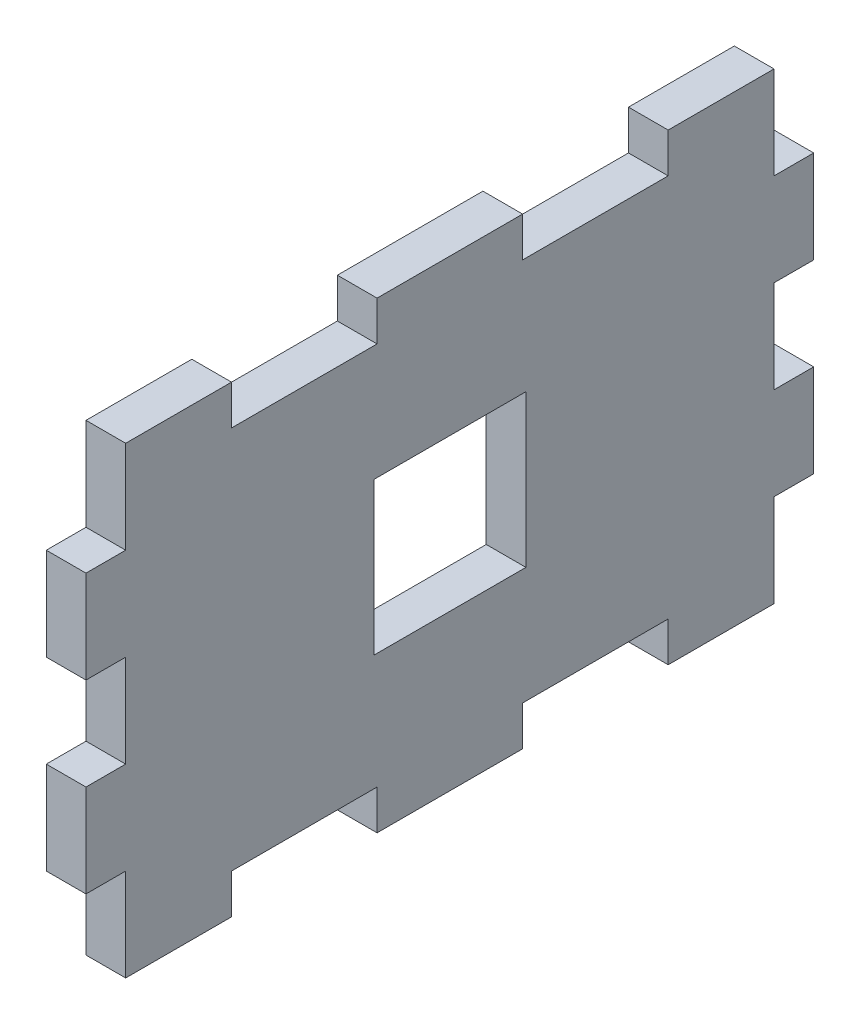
SolidWorks part; units mm, degrees
ref_plane "Front Plane" through (0, 0, 0) normal (0, 0, 1) x (1, 0, 0)
ref_plane "Top Plane" through (0, 0, 0) normal (0, 1, 0) x (1, 0, 0)
ref_plane "Right Plane" through (0, 0, 0) normal (1, 0, 0) x (0, 0, -1)
sketch "Sketch1" plane through (0, 0, 0) normal (1, 0, 0) x (0, 0, -1)
  line L1 (-27.5, 17.5) -> (27.5, 17.5)
  line L2 (-27.5, 17.5) -> (-27.5, -17.5)
  line L3 (-27.5, -17.5) -> (27.5, -17.5)
  line L4 (27.5, 17.5) -> (27.5, -17.5)
  line L5 (-27.5, 17.5) -> (27.5, -17.5) construction
  line L6 (-27.5, -17.5) -> (27.5, 17.5) construction
  point P0 (0, 0)
  dimension "D1" = 55
  dimension "D2" = 35
extrude "Boss-Extrude1" add sketch "Sketch1" along normal blind 3
sketch "Sketch3" plane through (3, 0, 0) normal (1, 0, 0) x (0, 0, -1)
  line L0 (-27.5, 17.5) -> (-16.5, 17.5)
  line L1 (27.5, 17.5) -> (-27.5, 17.5) construction
  line L2 (-16.5, 17.5) -> (-16.5, 14.5)
  line L3 (-16.5, 14.5) -> (-5.5, 14.5)
  line L4 (-5.5, 14.5) -> (-5.5, 17.5)
  line L5 (-5.5, 17.5) -> (5.5, 17.5)
  line L6 (5.5, 17.5) -> (5.5, 14.5)
  line L7 (5.5, 14.5) -> (16.5, 14.5)
  line L8 (16.5, 14.5) -> (16.5, 17.5)
  line L9 (16.5, 17.5) -> (27.5, 17.5)
  line L10 (-27.5, 0) -> (27.5, 0) construction
  line L11 (-27.5, 17.5) -> (-27.5, -17.5) construction
  line L12 (27.5, -17.5) -> (27.5, 17.5) construction
  line L13 (16.5, -17.5) -> (27.5, -17.5)
  line L14 (16.5, -14.5) -> (16.5, -17.5)
  line L15 (5.5, -14.5) -> (16.5, -14.5)
  line L16 (5.5, -17.5) -> (5.5, -14.5)
  line L17 (-5.5, -17.5) -> (5.5, -17.5)
  line L18 (-5.5, -14.5) -> (-5.5, -17.5)
  line L19 (-16.5, -14.5) -> (-5.5, -14.5)
  line L20 (-16.5, -17.5) -> (-16.5, -14.5)
  line L21 (-27.5, -17.5) -> (-16.5, -17.5)
  line L22 (-16.5, 17.5) -> (16.5, 17.5)
  line L23 (-16.5, -17.5) -> (16.5, -17.5)
extrude "Cut-Extrude1" cut sketch "Sketch3" against normal blind 3 contours L3 L4 L2 M12 | L7 L8 L6 M12 | L16 L14 L15 M14 | L20 L18 L19 M14
sketch "Sketch4" plane through (3, 0, 0) normal (1, 0, 0) x (0, 0, -1)
  line L0 (-27.5, 17.5) -> (-24.5, 17.5)
  line L1 (-16.5, 17.5) -> (-27.5, 17.5) construction
  line L2 (-24.5, 17.5) -> (-24.5, 10.5)
  line L3 (-24.5, 10.5) -> (-27.5, 10.5)
  line L4 (-27.5, 17.5) -> (-27.5, -17.5) construction
  line L5 (-27.5, 10.5) -> (-27.5, 3.5)
  line L6 (-27.5, 3.5) -> (-24.5, 3.5)
  line L7 (-24.5, 3.5) -> (-24.5, -3.5)
  line L8 (-24.5, -3.5) -> (-27.5, -3.5)
  line L9 (-27.5, -3.5) -> (-27.5, -10.5)
  line L10 (-27.5, -10.5) -> (-24.5, -10.5)
  line L11 (-24.5, -10.5) -> (-24.5, -17.5)
  line L12 (-24.5, -17.5) -> (-27.5, -17.5)
  line L15 (0, 17.5) -> (0, -17.5) construction
  line L16 (5.5, 17.5) -> (-5.5, 17.5) construction
  line L17 (-5.5, -17.5) -> (5.5, -17.5) construction
  line L18 (24.5, -17.5) -> (27.5, -17.5)
  line L19 (24.5, -10.5) -> (24.5, -17.5)
  line L20 (27.5, -10.5) -> (24.5, -10.5)
  line L21 (24.5, -3.5) -> (27.5, -3.5)
  line L22 (24.5, 3.5) -> (24.5, -3.5)
  line L23 (27.5, 3.5) -> (24.5, 3.5)
  line L24 (27.5, 10.5) -> (27.5, 3.5)
  line L25 (24.5, 10.5) -> (27.5, 10.5)
  line L26 (24.5, 17.5) -> (24.5, 10.5)
  line L27 (27.5, 17.5) -> (24.5, 17.5)
  line L28 (-27.5, 17.5) -> (-27.5, -17.5)
  line L29 (27.5, -17.5) -> (27.5, 17.5)
extrude "Cut-Extrude2" cut sketch "Sketch4" against normal blind 3 contours L3 L2 M6 M7 | L8 L7 L6 M7 | L11 L10 M7 M8 | L26 L25 M18 M17 | L23 L22 L21 M17 | L20 L19 M17 M16
sketch "Sketch5" plane through (3, 0, 0) normal (1, 0, 0) x (0, 0, -1)
  line L1 (-5.75, 5.75) -> (5.75, 5.75)
  line L2 (-5.75, 5.75) -> (-5.75, -5.75)
  line L3 (-5.75, -5.75) -> (5.75, -5.75)
  line L4 (5.75, 5.75) -> (5.75, -5.75)
  line L5 (-5.75, 5.75) -> (5.75, -5.75) construction
  line L6 (-5.75, -5.75) -> (5.75, 5.75) construction
  point P0 (0, 0)
  dimension "D1" = 11.5
  dimension "D2" = 11.5
extrude "Cut-Extrude3" cut sketch "Sketch5" against normal blind 41
equation "\"Thickness of material\"= 3mm"
equation "\"Length of box\"= 155mm"
equation "\"width of box\"= 55mm"
equation "\"D1@Boss-Extrude1\"=\"Thickness of material\""
equation "\"D1@Sketch3\"=\"width of box\"/5"
equation "\"D2@Sketch3\"=\"width of box\"/5"
equation "\"D3@Sketch3\"=\"width of box\"/5"
equation "\"D4@Sketch3\"=\"width of box\"/5"
equation "\"height of box\"= 35mm"
equation "\"D5@Sketch3\"=\"Thickness of material\""
equation "\"D6@Sketch3\"=\"Thickness of material\""
equation "\"D1@Sketch4\"=\"height of box\"/5"
equation "\"D2@Sketch4\"=\"height of box\"/5"
equation "\"D3@Sketch4\"=\"height of box\"/5"
equation "\"D4@Sketch4\"=\"height of box\"/5"
equation "\"D5@Sketch4\"=\"height of box\"/5"
equation "\"D6@Sketch4\"=\"Thickness of material\""
equation "\"D7@Sketch4\"=\"Thickness of material\""
equation "\"D8@Sketch4\"=\"Thickness of material\""
